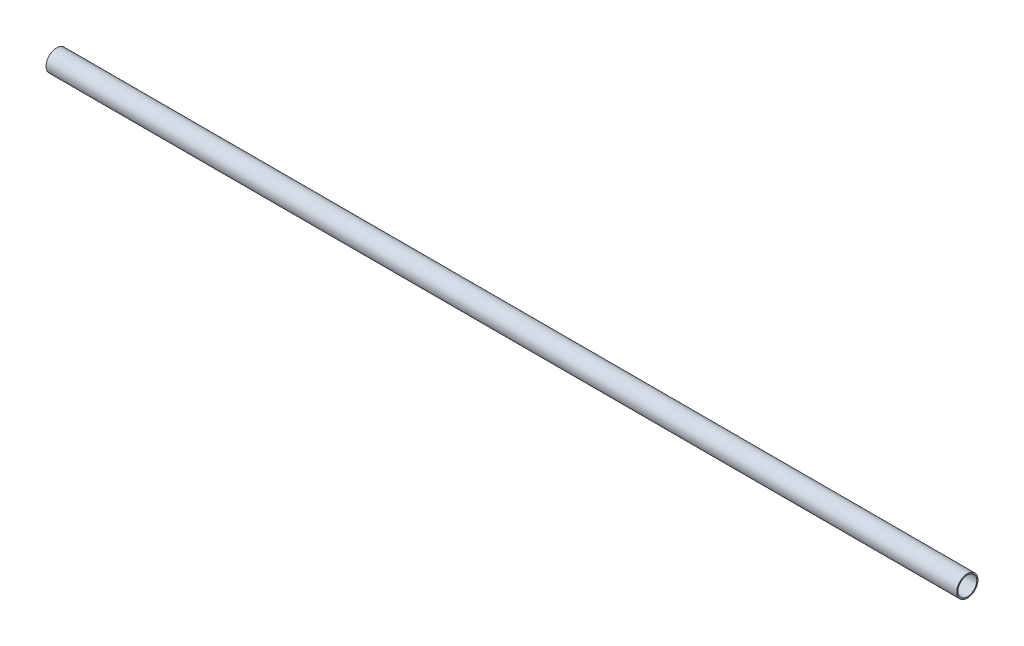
SolidWorks part; units mm, degrees
ref_plane "Plan de face" through (0, 0, 0) normal (0, 0, 1) x (1, 0, 0)
ref_plane "Plan de dessus" through (0, 0, 0) normal (0, 1, 0) x (1, 0, 0)
ref_plane "Plan de droite" through (0, 0, 0) normal (1, 0, 0) x (0, 0, -1)
sketch "Esquisse1" plane through (0, 0, 0) normal (1, 0, 0) x (0, 0, -1)
  circle A0 centre (0, 0) radius 17.5
  circle A1 centre (0, 0) radius 15.5
  dimension "D1" = 31
  dimension "D2" = 35
extrude "Boss.-Extru.1" add sketch "Esquisse1" along normal blind 1500
